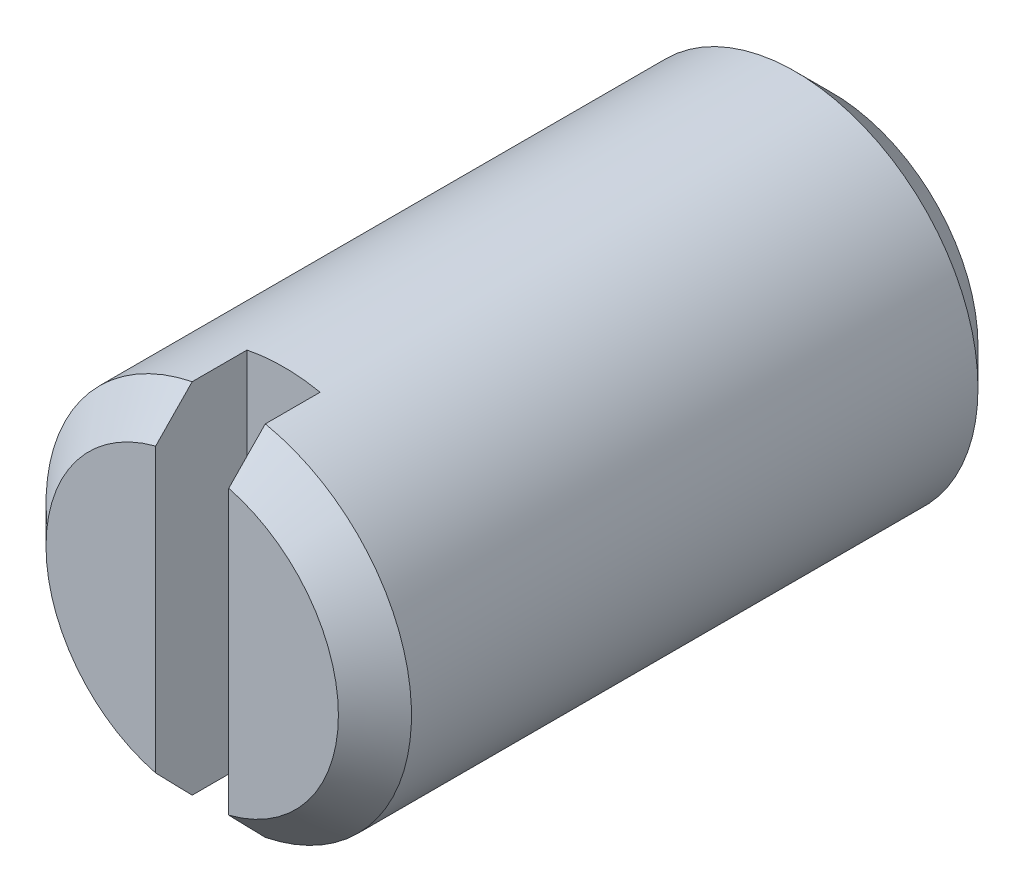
SolidWorks part; units mm, degrees
ref_plane "Plane1" through (0, 0, 0) normal (0, 0, 1) x (1, 0, 0)
ref_plane "Plane2" through (0, 0, 0) normal (0, 1, 0) x (1, 0, 0)
ref_plane "Plane3" through (0, 0, 0) normal (1, 0, 0) x (0, 0, -1)
sketch "Esquisse1" plane through (0, 0, 0) normal (0, 0, 1) x (1, 0, 0)
  circle A0 centre (0, 0) radius 1
  dimension "D1" = 2
extrude "Base-Extrusion" add sketch "Esquisse1" along normal blind 3.5
chamfer "Chanfrein1" distance 0.2 angle 45
sketch "Esquisse2" plane through (0, 0, 3.5) normal (0, 0, 1) x (1, 0, 0)
  line L0 (-0.2, -1.4) -> (0.2, -1.4)
  line L1 (-0.2, -1.4) -> (-0.2, 1.2)
  line L2 (0.2, 1.2) -> (-0.2, 1.2)
  line L3 (0.2, 1.2) -> (0.2, -1.4)
extrude "Enlèv. mat.-Extru.1" cut sketch "Esquisse2" against normal blind 0.5
